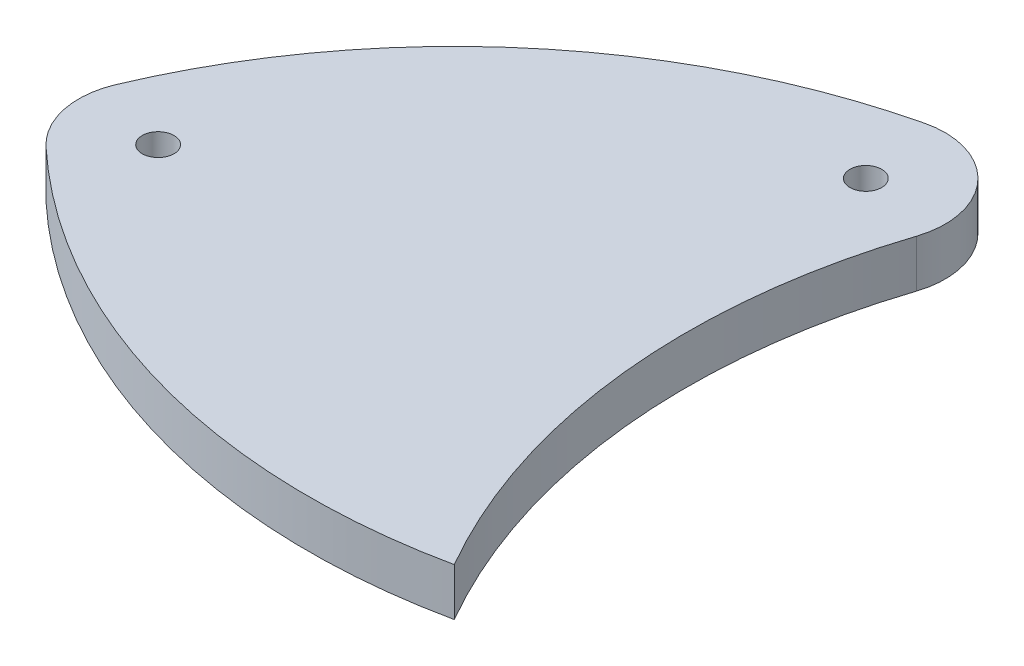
SolidWorks part; units mm, degrees
ref_plane "Plan de face" through (0, 0, 0) normal (0, 0, 1) x (1, 0, 0)
ref_plane "Plan de dessus" through (0, 0, 0) normal (0, 1, 0) x (1, 0, 0)
ref_plane "Plan de droite" through (0, 0, 0) normal (1, 0, 0) x (0, 0, -1)
sketch "Esquisse1" plane through (0, 0, 0) normal (0, 1, 0) x (1, 0, 0)
  line L0 (0, 0) -> (0, 40) construction
  line L1 (0, 0) -> (-38.0423, 12.3607) construction
  circle A0 centre (0, 0) radius 40 construction
  arc A1 (0, 0) -> (-3.3601, 32.4866) centre (34.641, 20) cw
  arc A2 (0, 0) -> (38.0423, 12.3607) centre (29.7258, -26.7652) cw construction
  arc A3 (0, 0) -> (23.5114, -32.3607) centre (-16.2695, -36.5418) cw construction
  arc A4 (0, 0) -> (-23.5114, -32.3607) centre (-39.7809, 4.1811) cw construction
  arc A5 (0, 0) -> (-35.6729, 9.9433) centre (-8.3165, 39.1259) cw
  arc A6 (-36.861, 15.5327) -> (-9.2689, 38.9113) centre (0, 0) cw
  circle A7 centre (0, 0) radius 35 construction
  circle A8 centre (-32.2534, 13.5911) radius 1
  circle A9 centre (-8.1103, 34.0474) radius 1
  arc A10 (-35.6729, 9.9433) -> (-36.861, 15.5327) centre (-32.2534, 13.5911) cw
  arc A11 (-3.3601, 32.4866) -> (-9.2689, 38.9113) centre (-8.1103, 34.0474) ccw
  point P15 (0, 0)
  dimension "D1" = 80
  dimension "D3" = 70
  dimension "D4" = 2
  dimension "D5" = 5
  dimension "D2" = 5
extrude "Boss.-Extru.1" add sketch "Esquisse1" along normal blind 3
